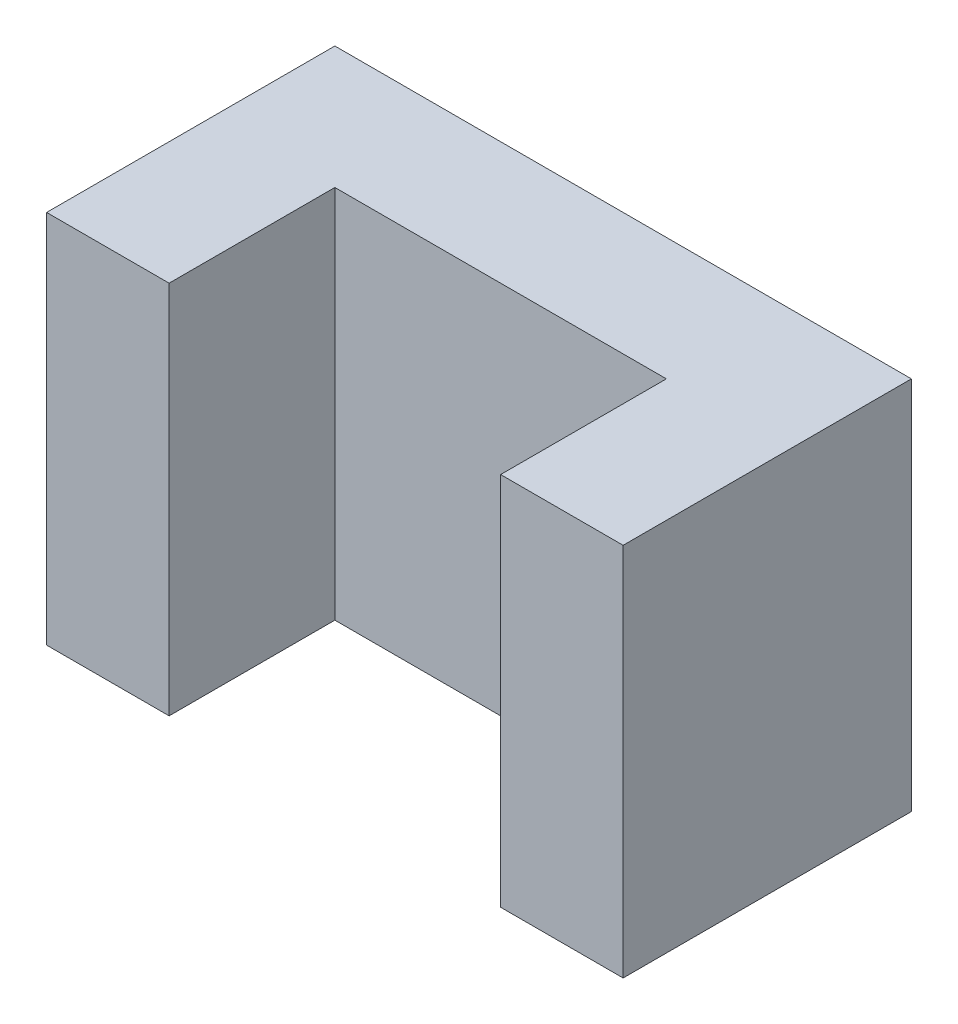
SolidWorks part; units mm, degrees
ref_plane "Front Plane" through (0, 0, 0) normal (0, 0, 1) x (1, 0, 0)
ref_plane "Top Plane" through (0, 0, 0) normal (0, 1, 0) x (1, 0, 0)
ref_plane "Right Plane" through (0, 0, 0) normal (1, 0, 0) x (0, 0, -1)
sketch "Sketch1" plane through (0, 0, 0) normal (0, 0, 1) x (1, 0, 0)
  line L0 (-45.4783, 7.7339) -> (14.5217, 7.7339) construction
  line L1 (-75.4783, 0.7339) -> (-35.4783, 0.7339)
  line L2 (-75.4783, 0.7339) -> (-75.4783, -25.2661)
  line L3 (-75.4783, -25.2661) -> (-35.4783, -25.2661)
  line L4 (-35.4783, 0.7339) -> (-35.4783, -25.2661)
  line L5 (14.5217, -32.2661) -> (-45.4783, -32.2661) construction
  line L6 (-45.4783, -32.2661) -> (-45.4783, 7.7339) construction
  line L7 (-65.4783, 27.7339) -> (-65.4783, -52.2661) construction
  dimension "D1" = 7
  dimension "D2" = 7
  dimension "D3" = 10
  dimension "D4" = 10
extrude "Extrude1" add sketch "Sketch1" against normal blind 20
other "Cavity1"
other "Body<1>@Force on a Magnetic Circuit1"
sketch "Local Files1" plane through (0, 0, 0) normal (0, 0, 1) x (1, 0, 0)
  line L0 (-65.4783, 0.7339) -> (-75.4783, 0.7339) construction
  line L1 (-66.9783, 0.7339) -> (-43.9783, 0.7339)
  line L2 (-66.9783, 0.7339) -> (-66.9783, -25.2661)
  line L3 (-66.9783, -25.2661) -> (-43.9783, -25.2661)
  line L4 (-43.9783, 0.7339) -> (-43.9783, -25.2661)
  line L5 (-45.4783, -25.2661) -> (-35.4783, -25.2661) construction
  line L6 (-45.4783, 0.7339) -> (-45.4783, -25.2661) construction
  line L7 (-65.4783, -25.2661) -> (-65.4783, 0.7339) construction
  dimension "D1" = 1.5
  dimension "D2" = 1.5
extrude "Cut-Extrude1" cut sketch "Local Files1" against normal blind 11.5
